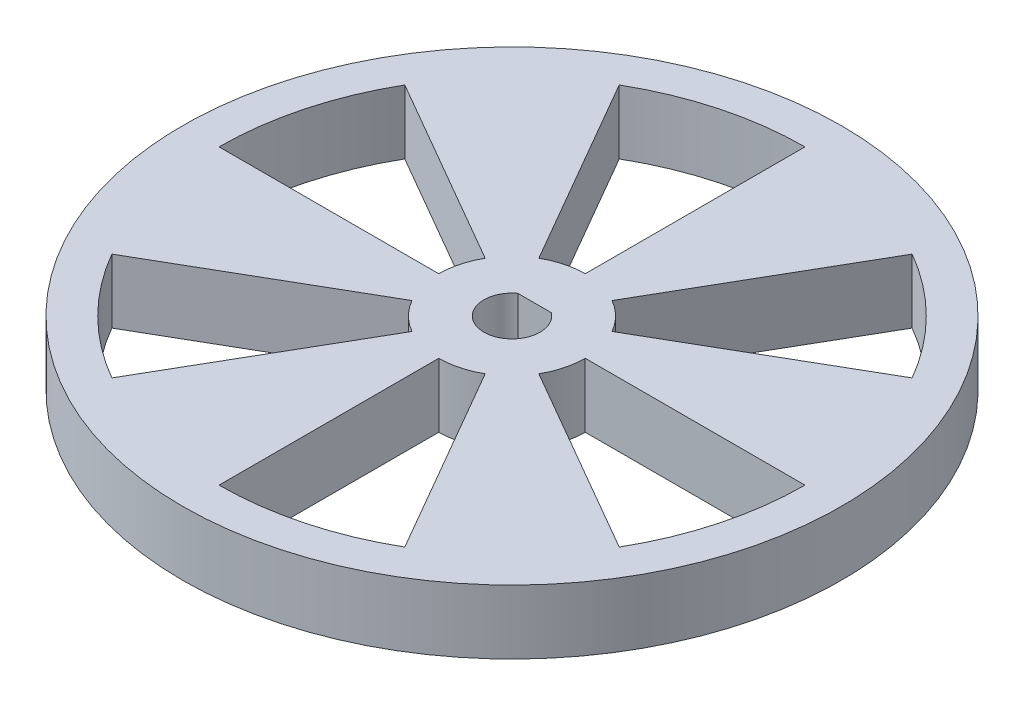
SolidWorks part; units mm, degrees
ref_plane "Front Plane" through (0, 0, 0) normal (0, 0, 1) x (1, 0, 0)
ref_plane "Top Plane" through (0, 0, 0) normal (0, 1, 0) x (1, 0, 0)
ref_plane "Right Plane" through (0, 0, 0) normal (1, 0, 0) x (0, 0, -1)
sketch "Sketch1" plane through (0, 0, 0) normal (0, 1, 0) x (1, 0, 0)
  line L0 (0, -8) -> (0, -32)
  line L1 (-4, 6.9282) -> (-16, 27.7128)
  line L2 (-6.9282, 4) -> (-27.7128, 16)
  line L3 (-8, 0) -> (-32, 0)
  line L4 (1.8319, 2.4636) -> (-1.8319, 2.4636)
  line L5 (6.9282, 4) -> (27.7128, 16)
  line L6 (4, 6.9282) -> (16, 27.7128)
  line L7 (0, 8) -> (0, 32)
  line L8 (4, -6.9282) -> (16, -27.7128)
  line L9 (6.9282, -4) -> (27.7128, -16)
  line L10 (8, 0) -> (32, 0)
  line L11 (-6.9282, -4) -> (-27.7128, -16)
  line L12 (-4, -6.9282) -> (-16, -27.7128)
  arc A0 (6.9282, -4) -> (8, 0) centre (0, 0) ccw
  arc A1 (-1.8319, 2.4636) -> (1.8319, 2.4636) centre (0, 0) ccw
  circle A2 centre (0, 0) radius 36
  arc A3 (0, -32) -> (16, -27.7128) centre (0, 0) ccw
  arc A4 (27.7128, -16) -> (32, 0) centre (0, 0) ccw
  arc A5 (27.7128, 16) -> (16, 27.7128) centre (0, 0) ccw
  arc A6 (0, -8) -> (4, -6.9282) centre (0, 0) ccw
  arc A7 (-6.9282, -4) -> (-4, -6.9282) centre (0, 0) ccw
  arc A8 (-27.7128, -16) -> (-16, -27.7128) centre (0, 0) ccw
  arc A9 (-6.9282, 4) -> (-8, 0) centre (0, 0) ccw
  arc A10 (-27.7128, 16) -> (-32, 0) centre (0, 0) ccw
  arc A11 (0, 32) -> (-16, 27.7128) centre (0, 0) ccw
  arc A12 (0, 8) -> (-4, 6.9282) centre (0, 0) ccw
  arc A13 (6.9282, 4) -> (4, 6.9282) centre (0, 0) ccw
  dimension "D1" = 2.4636
  dimension "D2" = 3.07
  dimension "D3" = 72
extrude "Extrude1" add sketch "Sketch1" along normal blind 7
